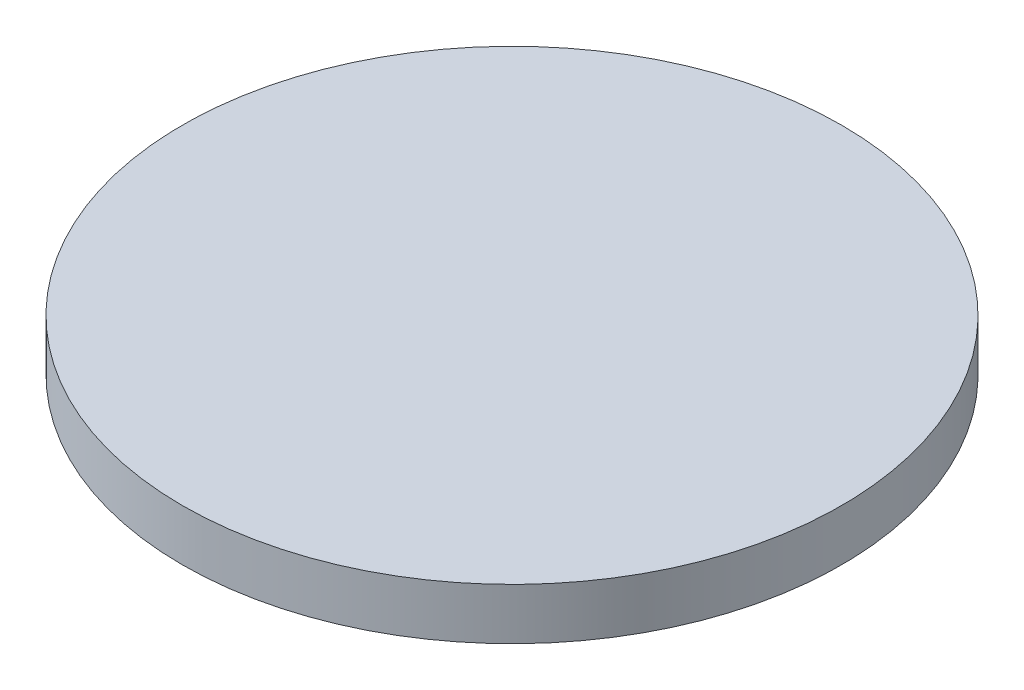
SolidWorks part; units mm, degrees
ref_plane "Front Plane" through (0, 0, 0) normal (0, 0, 1) x (1, 0, 0)
ref_plane "Top Plane" through (0, 0, 0) normal (0, 1, 0) x (1, 0, 0)
ref_plane "Right Plane" through (0, 0, 0) normal (1, 0, 0) x (0, 0, -1)
sketch "Sketch1" plane through (0, 0, 0) normal (0, 1, 0) x (1, 0, 0)
  circle A0 centre (0, 0) radius 19.25
  dimension "D1" = 38.5
extrude "Boss-Extrude1" add sketch "Sketch1" along normal blind 3
